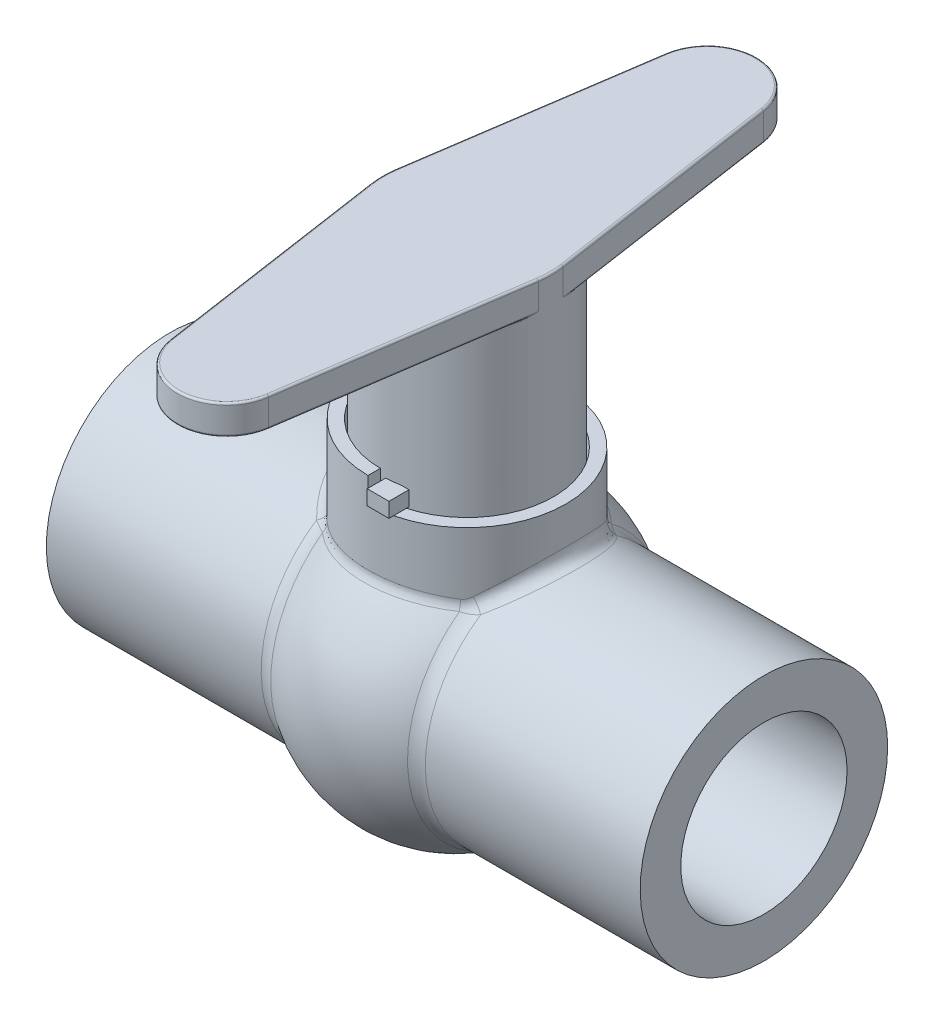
SolidWorks part; units mm, degrees
ref_plane "Front Plane" through (0, 0, 0) normal (0, 0, 1) x (1, 0, 0)
ref_plane "Top Plane" through (0, 0, 0) normal (0, 1, 0) x (1, 0, 0)
ref_plane "Right Plane" through (0, 0, 0) normal (1, 0, 0) x (0, 0, -1)
sketch "Sketch2" plane through (0, 0, 0) normal (1, 0, 0) x (0, 0, -1)
  circle A0 centre (0, 0) radius 15.875
  dimension "D1" = 31.75
extrude "Extrude1" add sketch "Sketch2" along normal mid plane 76.2
sketch "Sketch3" plane through (0, 0, 0) normal (0, 0, 1) x (1, 0, 0)
  line L0 (38.1, 15.875) -> (-38.1, 15.875) construction
  line L1 (0, 0) -> (27.2062, 0) construction
  line L2 (9.525, 15.875) -> (-9.525, 15.875)
  arc A0 (9.525, 15.875) -> (-9.525, 15.875) centre (0, 3.175) ccw
  dimension "D1" = 3.175
  dimension "D2" = 19.05
revolve "Revolve1" add sketch "Sketch3" angle 360 about L1
sketch "Sketch4" plane through (0, 0, 0) normal (0, 1, 0) x (1, 0, 0)
  circle A0 centre (0, 0) radius 12.7
  dimension "D1" = 25.4
extrude "Extrude2" add sketch "Sketch4" along normal blind 25.4
sketch "Sketch8" plane through (0, 0, 0) normal (1, 0, 0) x (0, 0, -1)
  line L0 (0, 19.6651) -> (0, -19.7066) construction
  line L1 (0, -16.51) -> (0, 16.51)
  arc A0 (0, 16.51) -> (0, -16.51) centre (0, 0) ccw
  arc A1 (-12.7, 14.199) -> (12.7, 14.199) centre (0, 0) ccw construction
  dimension "D1" = 2.54
revolve "Cut-Revolve1" cut sketch "Sketch8" angle 360 about L0
fillet "Fillet1" radius 3.175 2 edges at (9.525, -15.875, 0) (-9.525, -15.875, 0)
fillet "Fillet2" radius 1.5875 8 edges at (-9.6755, 13.7141, -8.2264) (-9.5172, 13.6602, 8.4091) (-12.6313, 15.8201, -1.3188) (1.3976, 14.1852, -12.6229) (-1.3976, 14.1852, 12.6229) (9.6755, 13.7141, 8.2264) (9.5172, 13.6602, -8.4091) (12.6241, 15.8143, 1.3867)
sketch "Sketch5" plane through (0, 25.4, 0) normal (0, 1, 0) x (-1, 0, 0)
  line L0 (0, 0) -> (0, 12.7)
  line L1 (0, 0) -> (12.7, 0)
  circle A1 centre (0, 0) radius 12.7
  arc A2 (0, 12.7) -> (12.7, 0) centre (0, 0) ccw
  dimension "D1" = 0
extrude "Cut-Extrude1" cut sketch "Sketch5" against normal blind 3.175
sketch "Sketch6" plane through (0, 25.4, 0) normal (0, 1, 0) x (-1, 0, 0)
  circle A1 centre (0, 0) radius 11.1125
  dimension "D1" = 22.225
extrude "Cut-Extrude2" cut sketch "Sketch6" against normal blind 7.62
sketch "Sketch7" plane through (38.1, 0, 0) normal (1, 0, 0) x (0, 0, -1)
  circle A0 centre (0, 0) radius 10.668
  dimension "D1" = 21.336
extrude "Cut-Extrude3" cut sketch "Sketch7" against normal blind 22.225
mirror "Mirror1" about plane through (0, 0, 0) normal (1, 0, 0) of "Cut-Extrude3"
ref_plane "Plane1" through (0, -18.288, 0) normal (0, 1, 0) x (-1, 0, 0)
other "SurfaceCut1"
sketch "Sketch9" plane through (0, 17.78, 0) normal (0, 1, 0) x (-1, 0, 0)
  circle A0 centre (0, 0) radius 6.35
  dimension "D1" = 12.7
extrude "Cut-Extrude4" cut sketch "Sketch9" against normal up to next
sketch "Sketch10" plane through (15.875, 0, 0) normal (1, 0, 0) x (0, 0, -1)
  circle A0 centre (0, 0) radius 7.8994
  dimension "D1" = 15.7988
extrude "Cut-Extrude5" cut sketch "Sketch10" against normal through all
sketch "Sketch12" plane through (0, 17.78, 0) normal (0, 1, 0) x (1, 0, 0)
  circle A3 centre (0, 0) radius 10.8585
  circle A4 centre (0, 0) radius 10.8585
  dimension "D1" = 0.254
extrude "Boss-Extrude1" add sketch "Sketch12" along normal blind 25.4
sketch "Sketch13" plane through (0, 43.18, 0) normal (0, 1, 0) x (1, 0, 0)
  line L0 (0, 31.75) -> (0, -31.75) construction
  line L1 (10.7417, 1.5884) -> (6.2817, 31.75)
  line L2 (0, 0) -> (50.6866, 0) construction
  line L3 (-6.2817, 31.75) -> (-10.7417, 1.5884)
  line L4 (10.7417, -1.5884) -> (6.2817, -31.75)
  line L5 (-6.2817, -31.75) -> (-10.7417, -1.5884)
  arc A1 (10.7417, -1.5884) -> (10.7417, 1.5884) centre (0, 0) ccw
  arc A2 (-6.2817, 31.75) -> (6.2817, 31.75) centre (0, 30.8211) cw
  arc A3 (-6.2817, -31.75) -> (6.2817, -31.75) centre (0, -30.8211) ccw
  arc A4 (-10.7417, 1.5884) -> (-10.7417, -1.5884) centre (0, 0) ccw
  circle A5 centre (0, 0) radius 10.8585 construction
  point P6 (0, 0)
  dimension "D1" = 6.35
  dimension "D2" = 63.5
extrude "Boss-Extrude2" add sketch "Sketch13" along normal blind 3.81
ref_plane "Plane2" through (0, 22.479, 0) normal (0, 1, 0) x (1, 0, 0)
sketch "Sketch14" plane through (0, 22.479, 0) normal (0, 1, 0) x (1, 0, 0)
  line L1 (0.4098, -10.6429) -> (3.1963, -10.6429)
  line L2 (0.4098, -10.6429) -> (0.4098, -13.2098)
  line L3 (0.4098, -13.2098) -> (3.1963, -13.2098)
  line L4 (3.1963, -10.6429) -> (3.1963, -13.2098)
  arc A0 (0, -11.1125) -> (-11.1125, 0) centre (0, 0) ccw construction
extrude "Boss-Extrude3" add sketch "Sketch14" along normal blind 1.905
fillet "Fillet3" radius 0.254 16 edges at (10.8585, 46.99, 0) (0, 46.99, 37.1711) (-10.8585, 46.99, 0) (0, 46.99, -37.1711) (0, 43.18, -37.1711) (0, 43.18, 37.1711) (-8.5117, 43.18, -16.6692) (-8.5117, 46.99, -16.6692) (-8.5117, 46.99, 16.6692) (-8.5117, 43.18, 16.6692) (8.5117, 46.99, 16.6692) (8.5117, 46.99, -16.6692) (8.5117, 43.18, -16.6692) (8.5117, 43.18, 16.6692) (0, 43.18, -10.8585) (0, 43.18, 10.8585)
